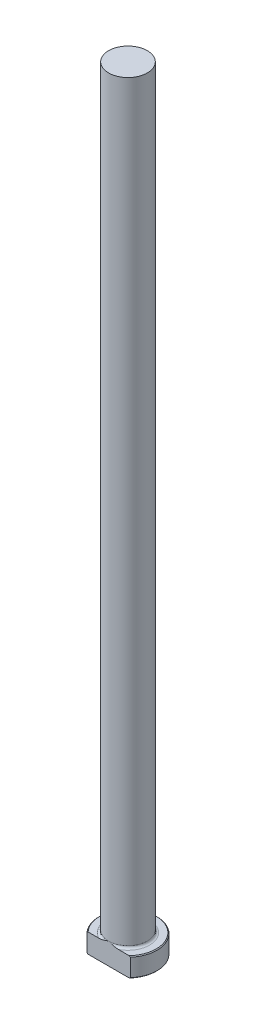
SolidWorks part; units mm, degrees
ref_plane "Front Plane" through (0, 0, 0) normal (0, 0, 1) x (1, 0, 0)
ref_plane "Top Plane" through (0, 0, 0) normal (0, 1, 0) x (1, 0, 0)
ref_plane "Right Plane" through (0, 0, 0) normal (1, 0, 0) x (0, 0, -1)
sketch "Sketch1" plane through (0, 0, 0) normal (0, 0, 1) x (1, 0, 0)
  line L0 (0, 259.9588) -> (0, -15.1925) construction
  line L1 (0, 0) -> (-9.525, 0)
  line L2 (-9.525, 0) -> (-9.525, 6.35)
  line L3 (-9.525, 6.35) -> (-6.35, 6.35)
  line L4 (-6.35, 6.35) -> (-6.35, 254)
  line L5 (-6.35, 254) -> (0, 254)
  line L6 (0, 254) -> (0, 0)
  dimension "L" = 254
  dimension "H" = 19.05
  dimension "T" = 6.35
  dimension "D" = 12.7
revolve "Revolve1" add sketch "Sketch1" angle 360 about L0
chamfer "Chamfer1" distance 0.254 angle 45 2 edges at (0, 6.35, 9.525) (0, 0, 9.525)
fillet "Fillet1" radius 0.762 1 edges at (0, 6.35, 6.35)
sketch "Sketch2" plane through (0, 0, 0) normal (0, 1, 0) x (1, 0, 0)
  line L0 (-7.0995, -6.35) -> (7.0995, -6.35)
  circle A0 centre (0, 0) radius 9.525 construction
  arc A1 (-7.0995, -6.35) -> (7.0995, -6.35) centre (0, 0) ccw
  circle A3 centre (0, 0) radius 6.35 construction
  dimension "D1" = 0
extrude "Key" cut sketch "Sketch2" along normal through all
sketch "Pocket Sketch" plane through (0, 0, 0) normal (0, 0, 1) x (1, 0, 0)
  line L0 (-9.9219, 0) -> (-9.9219, 6.3754)
  line L1 (-9.9219, 6.3754) -> (-7.5089, 6.3754)
  line L2 (-6.7469, 7.1374) -> (-6.7469, 22.225)
  line L3 (-6.7469, 22.225) -> (0, 22.225)
  line L4 (0, 22.225) -> (0, 0)
  line L5 (0, 0) -> (-9.9219, 0)
  line L6 (0, 12.6104) -> (0, -2.4989) construction
  line L7 (-9.525, 6.096) -> (-9.525, 0.254) construction
  line L8 (9.271, 6.35) -> (-9.271, 6.35) construction
  line L9 (-6.35, 254) -> (-6.35, 7.112) construction
  line L10 (-7.5089, 6.3754) -> (-6.7469, 7.1374)
  point P3 (-6.7469, 6.3754)
  dimension "D1" = 19.8437
  dimension "D2" = 0.3969
  dimension "D3" = 0.0254
  dimension "D4" = 0.3969
  dimension "D5" = 13.4937
  dimension "D6" = 22.225
